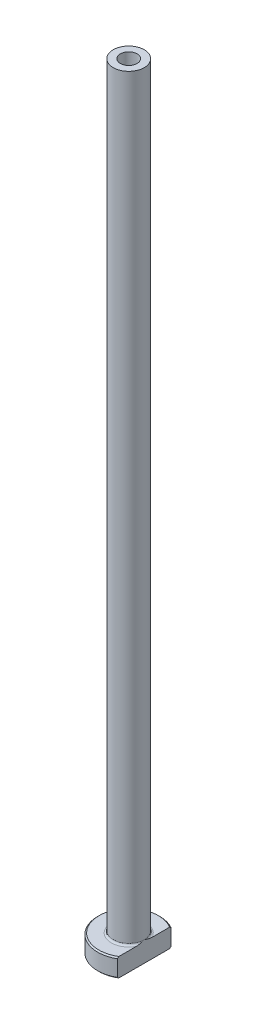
SolidWorks part; units mm, degrees
ref_plane "Front Plane" through (0, 0, 0) normal (0, 0, 1) x (1, 0, 0)
ref_plane "Top Plane" through (0, 0, 0) normal (0, 1, 0) x (1, 0, 0)
ref_plane "Right Plane" through (0, 0, 0) normal (1, 0, 0) x (0, 0, -1)
sketch "Sketch1" plane through (0, 0, 0) normal (0, 0, 1) x (1, 0, 0)
  line L0 (-1.35, 125) -> (-2.5, 125)
  line L1 (-2.5, 125) -> (-2.5, 3)
  line L2 (-2.5, 3) -> (-5, 3)
  line L3 (-5, 3) -> (-5, 0)
  line L4 (4.125, 0) -> (-4.125, 0) construction
  line L5 (-5, 0) -> (-1.6, 0)
  line L6 (-1.35, 80) -> (-1.35, 125)
  line L7 (0, 92.1877) -> (0, -15.5353) construction
  line L8 (0, -5.5) -> (0, 5.5) construction
  line L9 (-1.35, 80) -> (-1.6, 68)
  line L10 (-1.6, 68) -> (-1.6, 0)
  dimension "D1" = 0.25
  dimension "ID" = 2.7
  dimension "OD" = 5
  dimension "L" = 125
  dimension "H" = 10
  dimension "T" = 3
  dimension "N" = 45
  dimension "D2" = 12
  dimension "L-N" = 80
revolve "Revolve1" add sketch "Sketch1" angle 360 about L7
fillet "Fillet1" radius 0.3 1 edges at (0, 3, 2.5)
chamfer "Chamfer1" distance 0.2 angle 45 2 edges at (0, 3, 5) (0, 0, 5)
sketch "Sketch2" plane through (0, 0, 0) normal (0, -1, 0) x (1, 0, 0)
  line L0 (2.5, 4.3301) -> (2.5, -4.3301)
  circle A0 centre (0, 0) radius 5 construction
  arc A1 (2.5, 4.3301) -> (2.5, -4.3301) centre (0, 0) cw
  circle A2 centre (0, 0) radius 2.5 construction
extrude "Cut-Extrude1" cut sketch "Sketch2" against normal through all
chamfer "Chamfer2" distance 0.5 angle 45 1 edges at (0, 0, 1.6)
